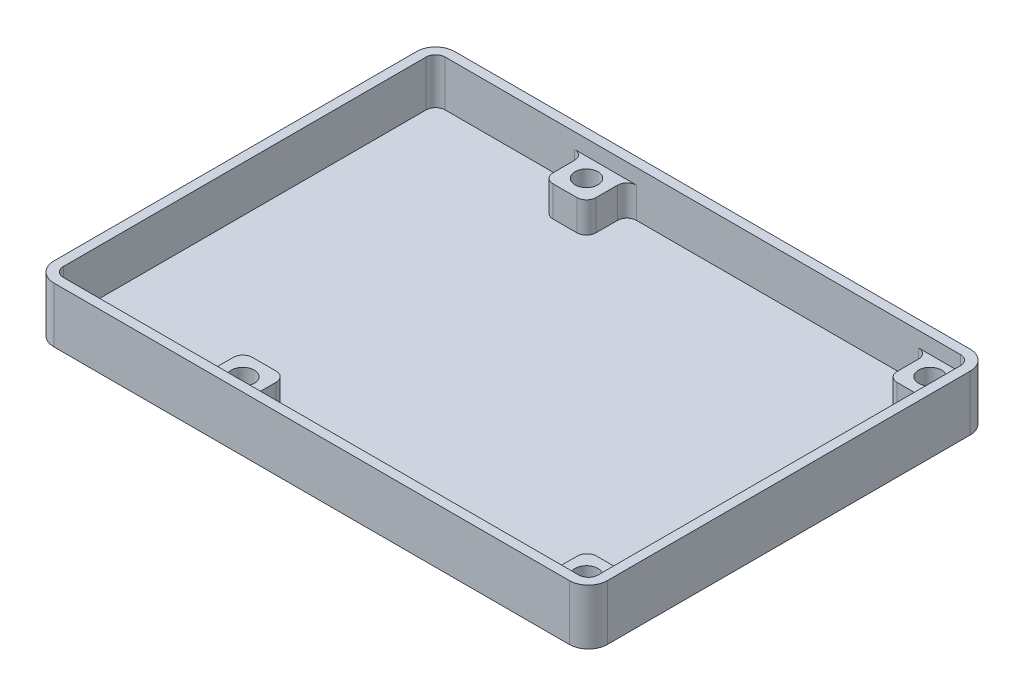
SolidWorks part; units mm, degrees
ref_plane "前视基准面" through (0, 0, 0) normal (0, 0, 1) x (1, 0, 0)
ref_plane "上视基准面" through (0, 0, 0) normal (0, 1, 0) x (1, 0, 0)
ref_plane "右视基准面" through (0, 0, 0) normal (1, 0, 0) x (0, 0, -1)
sketch "草图1" plane through (0, 0, 0) normal (0, 1, 0) x (1, 0, 0)
  line L1 (-28, 20) -> (28, 20)
  line L2 (-28, 20) -> (-28, -20)
  line L3 (-28, -20) -> (28, -20)
  line L4 (28, 20) -> (28, -20)
  line L5 (-28, 20) -> (28, -20) construction
  line L6 (-28, -20) -> (28, 20) construction
  point P0 (0, 0)
  dimension "D1" = 40
  dimension "D2" = 56
extrude "凸台-拉伸1" add sketch "草图1" along normal blind 1
fillet "圆角1" radius 1 4 edges at (-28, 0.5, 20) (-28, 0.5, -20) (28, 0.5, -20) (28, 0.5, 20)
sketch "草图2" plane through (0, 0, 0) normal (0, 1, 0) x (1, 0, 0)
  line L0 (-27, -20) -> (27, -20) construction
  line L1 (-10.2, 18) -> (25.8, 18) construction
  line L2 (-10.2, 18) -> (-10.2, -18) construction
  line L3 (-10.2, -18) -> (25.8, -18) construction
  line L4 (25.8, 18) -> (25.8, -18) construction
  line L5 (-10.2, 18) -> (25.8, -18) construction
  line L6 (-10.2, -18) -> (25.8, 18) construction
  line L7 (28, -19) -> (28, 19) construction
  circle A0 centre (-10.2, 18) radius 1.2
  circle A1 centre (25.8, 18) radius 1.2
  circle A2 centre (25.8, -18) radius 1.2
  circle A3 centre (-10.2, -18) radius 1.2
  point P0 (7.8, 0)
  point P19 (7.8, 0)
  dimension "D4" = 2.4
  dimension "D1" = 36
  dimension "D2" = 2
  dimension "D3" = 2.2
  dimension "D5" = 4
extrude "切除-拉伸1" cut sketch "草图2" along normal up to surface (1 mm away)
sketch "草图3" plane through (0, 0, 0) normal (0, 1, 0) x (1, 0, 0)
  line L8 (-29, 19) -> (-29, -19)
  line L9 (-27, -21) -> (27, -21)
  line L10 (29, -19) -> (29, 19)
  line L11 (27, 21) -> (-27, 21)
  line L12 (-29, 19) -> (-29, -19)
  line L13 (-27, -21) -> (27, -21)
  line L14 (29, -19) -> (29, 19)
  line L15 (27, 21) -> (-27, 21)
  line L16 (-28, 19) -> (-28, -19)
  line L17 (-27, -20) -> (27, -20)
  line L18 (28, -19) -> (28, 19)
  line L19 (27, 20) -> (-27, 20)
  line L20 (-28, 19) -> (-28, -19)
  line L21 (-27, -20) -> (27, -20)
  line L22 (28, -19) -> (28, 19)
  line L23 (27, 20) -> (-27, 20)
  arc A8 (-29, -19) -> (-27, -21) centre (-27, -19) ccw
  arc A9 (27, -21) -> (29, -19) centre (27, -19) ccw
  arc A10 (29, 19) -> (27, 21) centre (27, 19) ccw
  arc A11 (-27, 21) -> (-29, 19) centre (-27, 19) ccw
  arc A12 (-29, -19) -> (-27, -21) centre (-27, -19) ccw
  arc A13 (27, -21) -> (29, -19) centre (27, -19) ccw
  arc A14 (29, 19) -> (27, 21) centre (27, 19) ccw
  arc A15 (-27, 21) -> (-29, 19) centre (-27, 19) ccw
  arc A16 (-28, -19) -> (-27, -20) centre (-27, -19) ccw
  arc A17 (27, -20) -> (28, -19) centre (27, -19) ccw
  arc A18 (28, 19) -> (27, 20) centre (27, 19) ccw
  arc A19 (-27, 20) -> (-28, 19) centre (-27, 19) ccw
  arc A20 (-28, -19) -> (-27, -20) centre (-27, -19) ccw
  arc A21 (27, -20) -> (28, -19) centre (27, -19) ccw
  arc A22 (28, 19) -> (27, 20) centre (27, 19) ccw
  arc A23 (-27, 20) -> (-28, 19) centre (-27, 19) ccw
  dimension "D1" = 1
  dimension "D2" = 0
extrude "凸台-拉伸2" add sketch "草图3" along normal blind 5.8
sketch "草图5" plane through (0, 1, 0) normal (0, 1, 0) x (1, 0, 0)
  line L0 (28, -19) -> (28, 19) construction
  line L1 (23.6, 20.25) -> (28, 20.25)
  line L2 (23.6, 20.25) -> (23.6, 15.75)
  line L3 (23.6, 15.75) -> (28, 15.75)
  line L4 (28, 20.25) -> (28, 15.75)
  line L5 (23.6, 20.25) -> (28, 15.75) construction
  line L6 (23.6, 15.75) -> (28, 20.25) construction
  line L9 (23.6, -20.25) -> (28, -20.25)
  line L10 (23.6, -20.25) -> (23.6, -15.75)
  line L11 (23.6, -15.75) -> (28, -15.75)
  line L12 (28, -20.25) -> (28, -15.75)
  line L13 (23.6, -20.25) -> (28, -15.75) construction
  line L14 (23.6, -15.75) -> (28, -20.25) construction
  line L16 (-12.45, -20.25) -> (-7.95, -20.25)
  line L17 (-12.45, -20.25) -> (-12.45, -15.75)
  line L18 (-12.45, -15.75) -> (-7.95, -15.75)
  line L19 (-7.95, -20.25) -> (-7.95, -15.75)
  line L20 (-12.45, -20.25) -> (-7.95, -15.75) construction
  line L21 (-12.45, -15.75) -> (-7.95, -20.25) construction
  line L22 (-12.45, 20.25) -> (-7.95, 20.25)
  line L23 (-12.45, 20.25) -> (-12.45, 15.75)
  line L24 (-12.45, 15.75) -> (-7.95, 15.75)
  line L25 (-7.95, 20.25) -> (-7.95, 15.75)
  line L26 (-12.45, 20.25) -> (-7.95, 15.75) construction
  line L27 (-12.45, 15.75) -> (-7.95, 20.25) construction
  circle A0 centre (-10.2, -18) radius 1.2 construction
  circle A1 centre (25.8, -18) radius 1.2 construction
  circle A2 centre (25.8, 18) radius 1.2 construction
  circle A3 centre (-10.2, 18) radius 1.2 construction
  circle A4 centre (-10.2, -18) radius 1.2
  circle A5 centre (25.8, -18) radius 1.2
  circle A6 centre (25.8, 18) radius 1.2
  circle A7 centre (-10.2, 18) radius 1.2
  dimension "D1" = 4.5
  dimension "D2" = 4.5
  dimension "D3" = 4.5
  dimension "D4" = 4.5
extrude "凸台-拉伸3" add sketch "草图5" along normal offset from surface (3.2 mm away) 1.6
fillet "圆角2" radius 1 14 edges at (-12.45, 2.6, 20) (-7.95, 2.6, 20) (-12.45, 2.6, 15.75) (-7.95, 2.6, 15.75) (-12.45, 2.6, -20) (-12.45, 2.6, -15.75) (-7.95, 2.6, -15.75) (-7.95, 2.6, -20) (23.6, 2.6, 20) (23.6, 2.6, 15.75) (28, 2.6, 15.75) (28, 2.6, -15.75) (23.6, 2.6, -15.75) (23.6, 2.6, -20)
chamfer "倒角1" distance 1 angle 45 4 edges at (25.8, 0, 19.2) (-10.2, 0, 19.2) (25.8, 0, -16.8) (-10.2, 0, -16.8)
